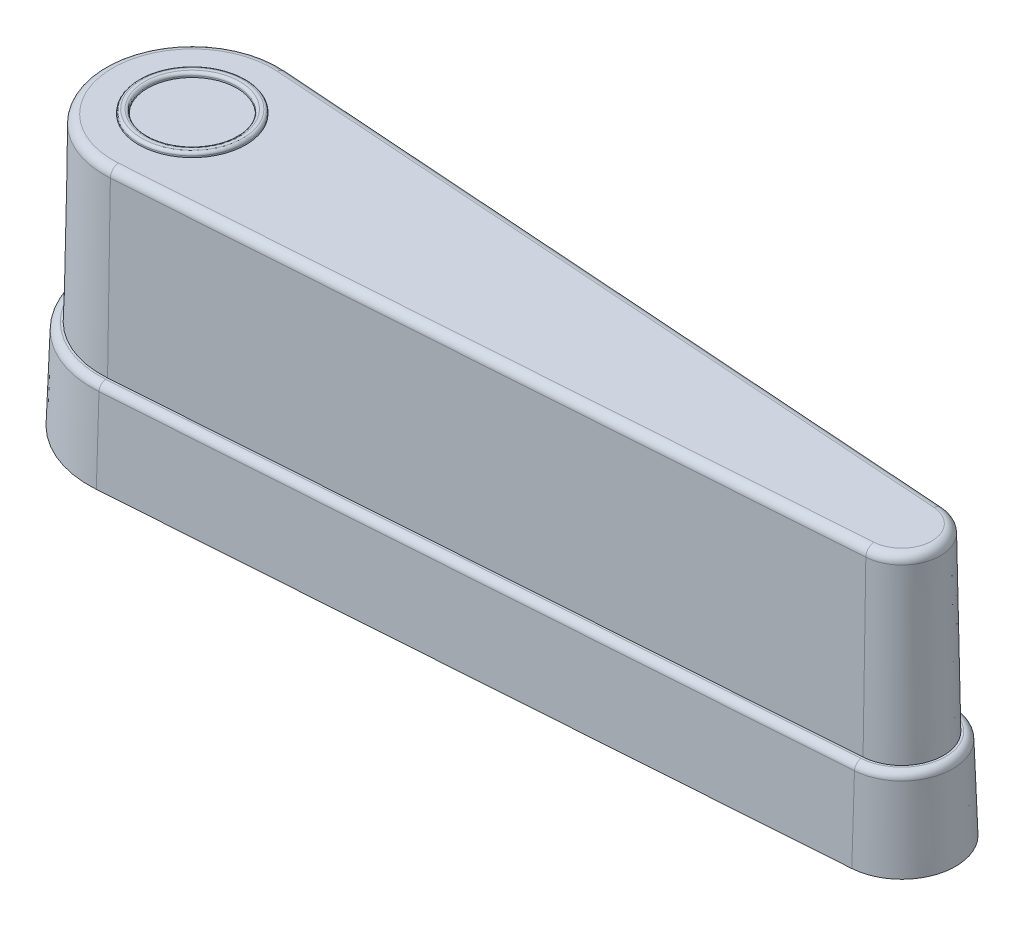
SolidWorks part; units mm, degrees
ref_plane "Front Plane" through (0, 0, 0) normal (0, 0, 1) x (1, 0, 0)
ref_plane "Top Plane" through (0, 0, 0) normal (0, 1, 0) x (1, 0, 0)
ref_plane "Right Plane" through (0, 0, 0) normal (1, 0, 0) x (0, 0, -1)
sketch "Sketch1" plane through (0, 0, 0) normal (0, 1, 0) x (1, 0, 0)
  line L0 (0, 0) -> (172.1019, 0) construction
  line L1 (0.5621, 8.0322) -> (62.8427, 3.674)
  line L2 (0.5621, -8.0322) -> (62.8427, -3.674)
  arc A0 (0.5621, 8.0322) -> (0.5621, -8.0322) centre (0, 0) ccw
  arc A1 (62.8427, -3.674) -> (62.8427, 3.674) centre (62.5856, 0) ccw
  dimension "D1" = 16.1036
  dimension "D2" = 7.366
  dimension "D3" = 74.3204
extrude "Boss-Extrude1" add sketch "Sketch1" along normal blind 15.875 draft 1
sketch "Sketch2" plane through (0, 0, 0) normal (0, -1, 0) x (1, 0, 0)
  line L4 (0.6175, -8.824) -> (62.8981, -4.4658)
  line L5 (62.8981, 4.4658) -> (0.6175, 8.824)
  line L6 (0.6175, -8.824) -> (62.8981, -4.4658)
  line L7 (62.8981, 4.4658) -> (0.6175, 8.824)
  arc A4 (0.6175, 8.824) -> (0.6175, -8.824) centre (0, 0) ccw
  arc A5 (62.8981, -4.4658) -> (62.8981, 4.4658) centre (62.5856, 0) ccw
  arc A6 (0.6175, 8.824) -> (0.6175, -8.824) centre (0, 0) ccw
  arc A7 (62.8981, -4.4658) -> (62.8981, 4.4658) centre (62.5856, 0) ccw
  dimension "D1" = 0.7937
extrude "Boss-Extrude2" add sketch "Sketch2" along normal blind 7.9375 draft 2
fillet "Fillet1" radius 0.762 4 edges at (-7.7747, 15.875, 0) (31.683, 15.875, -5.5767) (65.9915, 15.875, 0) (31.683, 15.875, 5.5767)
fillet "Fillet2" radius 0.635 4 edges at (67.0623, 0, 0) (31.7578, 0, -6.6449) (-8.8455, 0, 0) (31.7578, 0, 6.6449)
shell "Shell1" thickness 1.905
fillet "Fillet3" radius 0.635 4 edges at (-6.1798, -1.905, 0) (31.5717, -1.905, -3.9856) (64.3966, -1.905, 0) (31.5717, -1.905, 3.9856)
sketch "Sketch3" plane through (0, -7.9375, 0) normal (0, -1, 0) x (1, 0, 0)
  circle A0 centre (0, 0) radius 4.953
  dimension "D1" = 9.906
extrude "Boss-Extrude3" add sketch "Sketch3" against normal up to next draft 0.5
fillet "Fillet4" radius 0.635 1 edges at (0, -7.9375, -4.953)
sketch "Sketch4" plane through (0, -7.9375, 0) normal (0, -1, 0) x (1, 0, 0)
  circle A0 centre (0, 0) radius 3.175
  dimension "D1" = 6.35
extrude "Cut-Extrude1" cut sketch "Sketch4" against normal up to surface (21.9075 mm away)
ref_plane "Plane1" through (0, -4.9212, 0) normal (0, -1, 0) x (-1, 0, 0)
sketch "Sketch5" plane through (0, -4.9212, 0) normal (0, -1, 0) x (-1, 0, 0)
  line L0 (0, 3.8729) -> (0, 8.4751)
  line L1 (0, -3.8729) -> (0, -8.4751)
  circle A0 centre (0, 0) radius 3.8729 construction
  dimension "D1" = 7.7459
  dimension "D2" = 4.6021
rib "Rib1" sketch "Sketch5" sketch "Sketch5" thickness 2.54 extrusion direction normal to sketch draft on yes draft angle 1 parameters "D1"=2.54, "D3"=1
sketch "Sketch6" plane through (0, -4.9212, 0) normal (0, -1, 0) x (1, 0, 0)
  line L0 (0, 0) -> (60.2846, 0) construction
  line L1 (7.9375, -7.3028) -> (7.9375, 7.3028)
  line L2 (7.9375, 0) -> (3.7656, 0)
  line L3 (26.9875, -6.35) -> (26.9875, 6.35)
  line L4 (46.0375, -5.08) -> (46.0375, 5.08)
  point P5 (7.9375, 0)
  point P12 (26.9875, 0)
  point P13 (46.0375, 0)
  dimension "D1" = 7.9375
  dimension "D2" = 14.6055
  dimension "D3" = 19.05
  dimension "D4" = 19.05
  dimension "D5" = 10.16
  dimension "D6" = 12.7
rib "Rib2" sketch "Sketch6" sketch "Sketch6" thickness 1.27 extrusion direction normal to sketch draft on no parameters "D1"=1.27
fillet "Fillet5" radius 0.508 72 edges at (-1.4342, 4.4881, 4.854) (1.2963, -3.4131, 6.9851) (1.4342, 4.4881, 4.854) (1.4342, 4.4881, -4.854) (-1.4342, 4.4881, -4.854) (1.2963, -3.4131, -6.9851) (7.3025, -3.4131, -6.5648) (8.5725, -3.4131, -6.476) (7.3025, -3.4131, 6.5648) (8.5725, -3.4131, 6.476) (27.6225, -3.4131, -5.1429) (27.6225, -3.4131, 5.1429) (26.3525, -3.4131, -5.2318) (26.3525, -3.4131, 5.2318) (46.6725, -3.4131, 3.8099) (45.4025, -3.4131, 3.8988) (46.6725, -3.4131, -3.8099) (45.4025, -3.4131, -3.8988) (46.6725, -1.7229, 3.1083) (46.6725, -1.7229, -3.1083) (45.4025, -1.7229, 3.1972) (45.4025, -1.7229, -3.1972) (27.6225, -1.7229, 4.4413) (26.3525, -1.7229, -4.5302) (27.6225, -1.7229, -4.4413) (26.3525, -1.7229, 4.5302) (7.3025, -1.7229, 5.8632) (7.3025, -1.7229, -5.8632) (8.5725, -1.7229, 5.7744) (8.5725, -1.7229, -5.7744) (-1.27, -4.9212, 5.9058) (-0.3898, -4.9213, 7.1005) (0.8832, -4.9212, 7.0668) (1.27, -4.9212, 5.9272) (0, -4.9212, 4.9793) (0, -4.9212, -4.9793) (1.27, -4.9212, -5.9272) (0.8832, -4.9212, -7.0668) (-0.3898, -4.9212, -7.1005) (-1.27, -4.9212, -5.9058) (7.9375, -4.9212, -6.5732) (7.3025, -4.9212, -3.6263) (6.1206, -4.9212, -0.635) (4.9793, -4.9212, 0) (6.1206, -4.9212, 0.635) (7.3025, -4.9212, 3.6263) (7.9375, -4.9213, 6.5732) (8.5725, -4.9212, 0) (27.6225, -4.9212, 0) (26.9875, -4.9212, -5.2402) (26.3525, -4.9212, 0) (26.9875, -4.9212, 5.2402) (46.0375, -4.9213, 3.9071) (46.6725, -4.9212, 0) (46.0375, -4.9212, -3.9071) (45.4025, -4.9212, 0) (46.6725, 6.3445, 2.7846) (46.6725, 6.3445, -2.7846) (45.4025, 6.3445, 2.8734) (45.4025, 6.3445, -2.8734) (27.6225, 6.3445, 4.1176) (26.3525, 6.3445, -4.2065) (27.6225, 6.3445, -4.1176) (26.3525, 6.3445, 4.2065) (7.3025, 6.3445, 5.5395) (7.3025, 6.3445, -5.5395) (8.5725, 6.3445, 5.4507) (8.5725, 6.3445, -5.4507)
sketch "Sketch7" plane through (0, 15.875, 0) normal (0, 1, 0) x (1, 0, 0)
  circle A0 centre (0, 0) radius 4.7244
  dimension "D1" = 9.4488
extrude "Extrude-Thin1" add sketch "Sketch7" along normal blind 0.381 draft 1 thin
fillet "Fillet6" radius 0.254 2 edges at (0, 16.256, 3.9437) (0, 16.256, 4.7177)
